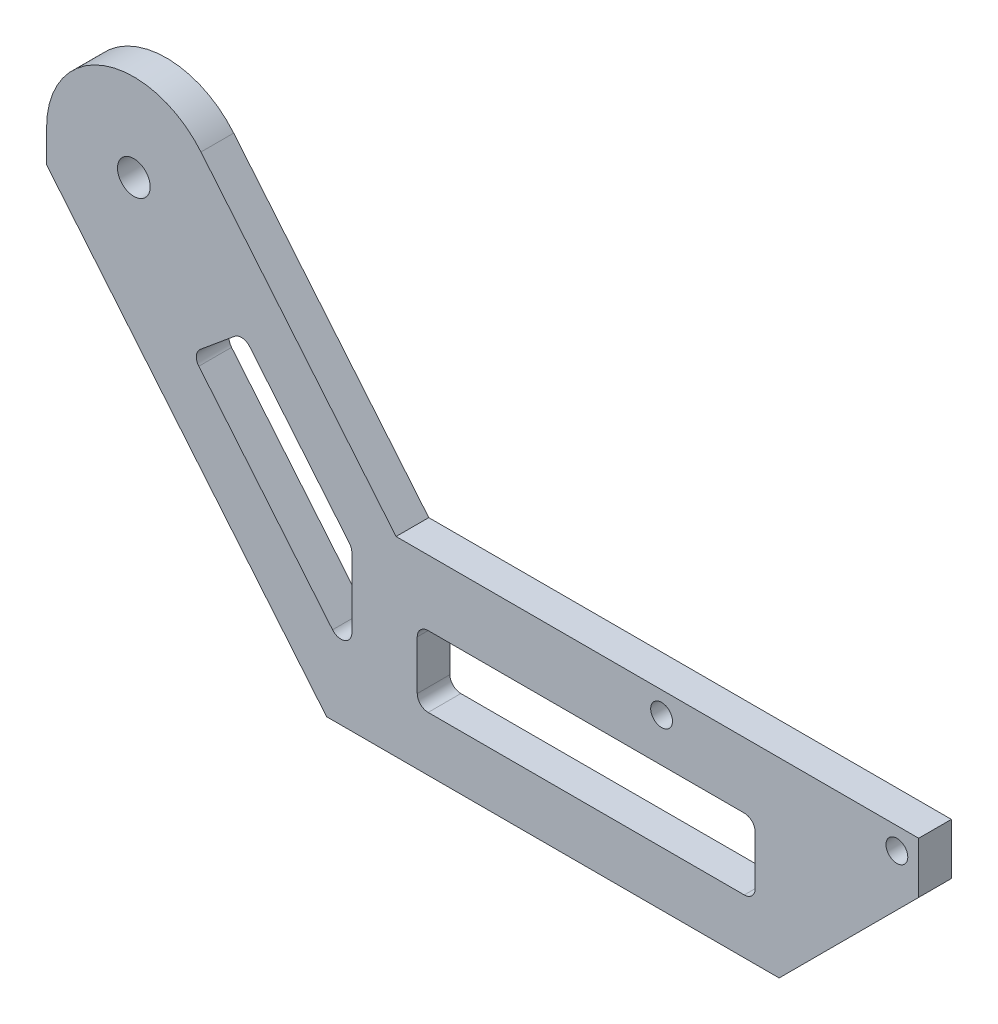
SolidWorks part; units mm, degrees
ref_plane "Front Plane" through (0, 0, 0) normal (0, 0, 1) x (1, 0, 0)
ref_plane "Top Plane" through (0, 0, 0) normal (0, 1, 0) x (1, 0, 0)
ref_plane "Right Plane" through (0, 0, 0) normal (1, 0, 0) x (0, 0, -1)
sketch "Sketch1" plane through (0, 0, 0) normal (0, 0, 1) x (1, 0, 0)
  line L1 (-25.4, 25.4) -> (43.508, 25.4)
  line L2 (43.508, 25.4) -> (107.95, -52.3748)
  line L3 (107.95, -52.3748) -> (228.6, -52.3748)
  line L4 (228.6, -52.3748) -> (228.6, -120.65)
  line L5 (228.6, -120.65) -> (66.675, -120.65)
  line L6 (66.675, -120.65) -> (-25.4, -9.525)
  line L7 (0, 0) -> (48.4812, 0) construction
  line L8 (0, 0) -> (0, -60.1857) construction
  line L9 (-25.4, 25.4) -> (-25.4, -9.525)
  line L10 (-5.1429, -33.9732) -> (9.9522, -21.4657) construction
  line L11 (-21.3486, -14.4146) -> (-6.8855, -2.431) construction
  circle A0 centre (0, 0) radius 4.7625
  circle A1 centre (222.25, -58.7248) radius 3.175
  circle A2 centre (153.7208, -58.7248) radius 3.175
  circle A3 centre (75.4515, -106.5144) radius 3.9624
  circle A4 centre (208.6216, -80.2386) radius 4.7625
  circle A5 centre (190.5, -98.425) radius 2.3876
  circle A6 centre (215.9, -98.425) radius 2.3876
  dimension "D1" = 9.525
  dimension "D13" = 6.35
  dimension "D16" = 6.35
  dimension "D21" = 9.525
  dimension "D22" = 7.9248
  dimension "D26" = 4.7752
  dimension "D2" = 228.6
  dimension "D3" = 25.4
  dimension "D4" = 254
  dimension "D5" = 120.65
  dimension "D6" = 52.3748
  dimension "D7" = 66.675
  dimension "D8" = 146.05
  dimension "D9" = 161.925
  dimension "D10" = 120.65
  dimension "D11" = 34.925
  dimension "D12" = 6.35
  dimension "D14" = 6.35
  dimension "D15" = 68.5292
  dimension "D17" = 130.5306
  dimension "D18" = 135.7376
  dimension "D19" = 223.52
  dimension "D20" = 27.8638
  dimension "D23" = 7.2784
  dimension "D24" = 25.4
  dimension "D25" = 6.35
  dimension "D27" = 22.225
  dimension "D28" = 12.7
  dimension "D29" = 25.4
  dimension "D30" = 18.1864
  dimension "D31" = 75.4515
  dimension "D32" = 106.5144
  dimension "D33" = 25.4
  dimension "D34" = 40.4114
  dimension "D35" = 19.9784
sketch "Sketch2" plane through (0, 0, 0) normal (0, 0, 1) x (1, 0, 0)
  line L2 (-25.4, 25.4) -> (43.508, 25.4) construction
  line L3 (43.508, 25.4) -> (107.95, -52.3748) construction
  line L4 (107.95, -52.3748) -> (228.6, -52.3748) construction
  line L5 (228.6, -52.3748) -> (228.6, -120.65) construction
  line L6 (228.6, -120.65) -> (66.675, -120.65) construction
  line L7 (66.675, -120.65) -> (-25.4, -9.525) construction
  line L8 (-25.4, 25.4) -> (-25.4, -9.525) construction
  line L9 (-25.4, 25.4) -> (43.508, 25.4)
  line L10 (43.508, 25.4) -> (107.95, -52.3748)
  line L11 (107.95, -52.3748) -> (228.6, -52.3748)
  line L12 (228.6, -52.3748) -> (228.6, -120.65)
  line L13 (228.6, -120.65) -> (66.675, -120.65)
  line L14 (66.675, -120.65) -> (-25.4, -9.525)
  line L15 (-25.4, 25.4) -> (-25.4, -9.525)
  circle A0 centre (0, 0) radius 4.7625 construction
  circle A1 centre (0, 0) radius 4.7625
  circle A2 centre (153.7208, -58.7248) radius 3.175 construction
  circle A3 centre (222.25, -58.7248) radius 3.175 construction
  circle A4 centre (153.7208, -58.7248) radius 3.175
  circle A5 centre (222.25, -58.7248) radius 3.175
extrude "Boss-Extrude1" add sketch "Sketch2" along normal mid plane 9.525
sketch "Sketch3" plane through (-19.74, -16.356, 0) normal (-0.77, -0.638, 0) x (0, 0, 1)
  circle A0 centre (0, 2.5212) radius 2.3876
  circle A1 centre (0, -22.8788) radius 2.3876
  dimension "D1" = 4.7752
extrude "Cut-Extrude1" cut sketch "Sketch3" against normal blind 15.24
sketch "Sketch4" plane through (0, 0, 0) normal (0, 0, 1) x (1, 0, 0)
  line L0 (66.675, -120.65) -> (-25.4, -9.525) construction
  line L1 (-25.4, 25.4) -> (-25.4, -9.525) construction
  line L2 (-25.4, 25.4) -> (43.508, 25.4) construction
  line L3 (43.508, 25.4) -> (107.95, -52.3748) construction
  line L4 (107.95, -52.3748) -> (228.6, -52.3748) construction
  line L5 (228.6, -52.3748) -> (228.6, -120.65) construction
  line L6 (228.6, -120.65) -> (66.675, -120.65) construction
  line L7 (66.675, -120.65) -> (-25.4, -9.525)
  line L8 (-25.4, 25.4) -> (-25.4, -9.525)
  line L9 (-25.4, 25.4) -> (43.508, 25.4)
  line L10 (43.508, 25.4) -> (107.95, -52.3748)
  line L11 (107.95, -52.3748) -> (228.6, -52.3748)
  line L12 (228.6, -52.3748) -> (228.6, -120.65)
  line L13 (228.6, -120.65) -> (66.675, -120.65)
  line L14 (19.5585, 16.2057) -> (76.3824, -52.3748)
  line L15 (107.95, -52.3748) -> (76.3824, -52.3748)
  line L16 (228.6, -107.95) -> (104.775, -107.95)
  line L17 (180.975, -71.4248) -> (180.975, -92.075)
  line L18 (180.975, -92.075) -> (82.55, -92.075)
  line L19 (82.55, -92.075) -> (82.55, -71.4248)
  line L20 (82.55, -71.4248) -> (180.975, -71.4248)
  line L21 (31.7591, -23.4009) -> (63.5, -61.7089)
  line L22 (63.5, -61.7089) -> (63.5, -91.9364)
  line L23 (63.5, -91.9364) -> (16.9087, -35.7055)
  line L24 (16.9087, -35.7055) -> (31.7591, -23.4009)
  line L25 (104.775, -107.95) -> (56.1521, -107.95)
  circle A0 centre (0, 0) radius 4.7625 construction
  circle A1 centre (75.4515, -106.5144) radius 3.9624 construction
  circle A2 centre (190.5, -98.425) radius 2.3876 construction
  circle A3 centre (215.9, -98.425) radius 2.3876 construction
  circle A4 centre (208.6216, -80.2386) radius 4.7625 construction
  circle A5 centre (222.25, -58.7248) radius 3.175 construction
  circle A6 centre (153.7208, -58.7248) radius 3.175 construction
  circle A7 centre (0, 0) radius 4.7625
  circle A8 centre (75.4515, -106.5144) radius 3.9624
  circle A9 centre (190.5, -98.425) radius 2.3876
  circle A10 centre (215.9, -98.425) radius 2.3876
  circle A11 centre (208.6216, -80.2386) radius 4.7625
  circle A12 centre (222.25, -58.7248) radius 3.175
  circle A13 centre (153.7208, -58.7248) radius 3.175
  circle A14 centre (0, 0) radius 25.4
  arc A15 (104.775, -107.95) -> (92.075, -120.65) centre (104.775, -120.65) ccw
  dimension "D1" = 12.7
  dimension "D2" = 12.7
  dimension "D3" = 123.825
  dimension "D4" = 15.875
  dimension "D5" = 15.875
  dimension "D6" = 19.05
  dimension "D7" = 15.875
  dimension "D8" = 47.625
  dimension "D9" = 98.425
  dimension "D10" = 19.05
  dimension "D11" = 73.025
sketch "Sketch6" plane through (0, 0, 0) normal (0, 0, 1) x (1, 0, 0)
  line L0 (228.6, -120.65) -> (66.675, -120.65) construction
  line L1 (228.6, -52.3748) -> (228.6, -120.65) construction
  line L2 (107.95, -52.3748) -> (228.6, -52.3748) construction
  line L3 (107.95, -52.3748) -> (76.3824, -52.3748) construction
  line L4 (19.5585, 16.2057) -> (76.3824, -52.3748) construction
  line L5 (-25.4, 25.4) -> (-25.4, -9.525) construction
  line L6 (66.675, -120.65) -> (-25.4, -9.525) construction
  line L7 (228.6, -107.95) -> (104.775, -107.95) construction
  line L8 (92.075, -120.65) -> (66.675, -120.65)
  line L9 (228.6, -52.3748) -> (228.6, -107.95)
  line L10 (107.95, -52.3748) -> (228.6, -52.3748)
  line L11 (107.95, -52.3748) -> (76.3824, -52.3748)
  line L12 (19.5585, 16.2057) -> (76.3824, -52.3748)
  line L13 (-25.4, 0) -> (-25.4, -9.525)
  line L14 (66.675, -120.65) -> (-25.4, -9.525)
  line L15 (228.6, -107.95) -> (104.775, -107.95)
  circle A0 centre (0, 0) radius 25.4 construction
  arc A1 (104.775, -107.95) -> (92.075, -120.65) centre (104.775, -120.65) ccw construction
  arc A2 (19.5585, 16.2057) -> (-25.4, 0) centre (0, 0) ccw
  arc A3 (104.775, -107.95) -> (92.075, -120.65) centre (104.775, -120.65) ccw
  circle A4 centre (75.4515, -106.5144) radius 3.9624 construction
  circle A5 centre (75.4515, -106.5144) radius 3.9624
  circle A6 centre (190.5, -98.425) radius 2.3876 construction
  circle A7 centre (215.9, -98.425) radius 2.3876 construction
  circle A8 centre (208.6216, -80.2386) radius 4.7625 construction
  circle A9 centre (190.5, -98.425) radius 2.3876
  circle A10 centre (215.9, -98.425) radius 2.3876
  circle A11 centre (208.6216, -80.2386) radius 4.7625
extrude "Cut-Extrude2" [suppressed] cut sketch "Sketch6" against normal mid plane 12.7 flip side to cut
sketch "Sketch7" plane through (0, 0, 0) normal (0, 0, 1) x (1, 0, 0)
  line L0 (63.5, -91.9364) -> (16.9087, -35.7055) construction
  line L1 (16.9087, -35.7055) -> (31.7591, -23.4009) construction
  line L2 (31.7591, -23.4009) -> (63.5, -61.7089) construction
  line L3 (63.5, -61.7089) -> (63.5, -91.9364) construction
  line L4 (180.975, -92.075) -> (82.55, -92.075) construction
  line L5 (82.55, -92.075) -> (82.55, -71.4248) construction
  line L6 (82.55, -71.4248) -> (180.975, -71.4248) construction
  line L7 (180.975, -71.4248) -> (180.975, -92.075) construction
  line L8 (63.5, -91.9364) -> (16.9087, -35.7055)
  line L9 (16.9087, -35.7055) -> (31.7591, -23.4009)
  line L10 (31.7591, -23.4009) -> (63.5, -61.7089)
  line L11 (63.5, -61.7089) -> (63.5, -91.9364)
  line L12 (180.975, -92.075) -> (82.55, -92.075)
  line L13 (82.55, -92.075) -> (82.55, -71.4248)
  line L14 (82.55, -71.4248) -> (180.975, -71.4248)
  line L15 (180.975, -71.4248) -> (180.975, -92.075)
extrude "Cut-Extrude3" cut sketch "Sketch7" against normal mid plane 12.7
chamfer "Chamfer1" [suppressed] distance 2.54 angle 45
fillet "Fillet1" radius 3.175 8 edges at (16.9087, -35.7055, 0) (31.7591, -23.4009, 0) (63.5, -61.7089, 0) (63.5, -91.9364, 0) (180.975, -92.075, 0) (180.975, -71.4248, 0) (82.55, -71.4248, 0) (82.55, -92.075, 0)
sketch "Sketch8" plane through (0, 0, 0) normal (0, 0, 1) x (1, 0, 0)
  line L0 (19.5585, 16.2057) -> (76.3824, -52.3748) construction
  line L1 (107.95, -52.3748) -> (76.3824, -52.3748) construction
  line L2 (107.95, -52.3748) -> (228.6, -52.3748) construction
  line L3 (228.6, -52.3748) -> (228.6, -120.65) construction
  line L4 (228.6, -107.95) -> (104.775, -107.95) construction
  line L5 (104.775, -107.95) -> (56.1521, -107.95) construction
  line L6 (66.675, -120.65) -> (-25.4, -9.525) construction
  line L7 (19.5585, 16.2057) -> (76.3824, -52.3748)
  line L8 (107.95, -52.3748) -> (76.3824, -52.3748)
  line L9 (107.95, -52.3748) -> (228.6, -52.3748)
  line L10 (228.6, -52.3748) -> (228.6, -107.95)
  line L11 (228.6, -107.95) -> (104.775, -107.95)
  line L12 (104.775, -107.95) -> (56.1521, -107.95)
  line L13 (56.1521, -107.95) -> (-25.4, -9.525)
  line L14 (-25.4, 25.4) -> (-25.4, -9.525) construction
  line L15 (-25.4, 0) -> (-25.4, -9.525)
  circle A0 centre (0, 0) radius 25.4 construction
  arc A1 (19.5585, 16.2057) -> (-25.4, 0) centre (0, 0) ccw
extrude "Cut-Extrude6" cut sketch "Sketch8" against normal mid plane 25.4 flip side to cut
chamfer "Chamfer2" distance 40.64 angle 45 1 edges at (228.6, -107.95, 0)
